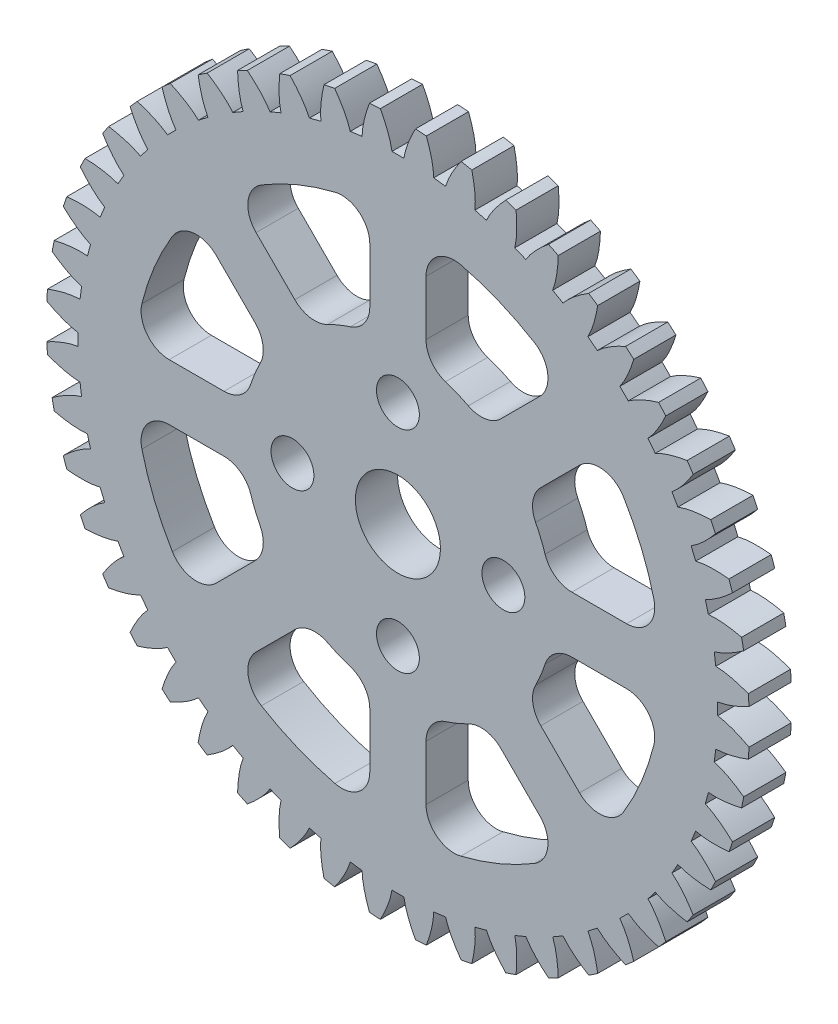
SolidWorks part; units mm, degrees
ref_plane "正面" through (0, 0, 0) normal (0, 0, 1) x (1, 0, 0)
ref_plane "平面" through (0, 0, 0) normal (0, 1, 0) x (1, 0, 0)
ref_plane "右側面" through (0, 0, 0) normal (1, 0, 0) x (0, 0, -1)
sketch "インボリュート スケッチ" plane through (0, 0, 0) normal (0, 0, 1) x (1, 0, 0)
  line L0 (-70.438, -23.8116) -> (0.4019, -22.549)
  line L1 (0.4019, -22.549) -> (-0.4019, 22.549) construction
  line L2 (0, 0) -> (0, 25) construction
  line L3 (-0.4019, 22.549) -> (-0.4054, 22.7464)
  line L4 (0, 0) -> (0.4019, -22.549)
  line L5 (-0.4054, 22.7464) -> (0, 22.7464)
  line L6 (0, 22.7464) -> (0, 0)
  circle A0 centre (0, 0) radius 22.5526 construction
  circle A1 centre (0, 0) radius 24 construction
  circle A2 centre (0, 0) radius 22.75 construction
  circle A3 centre (0, 0) radius 25 construction
  spline S0 degree 4 poles (-0.4019, 22.549) (-0.4043, 22.5919) (-0.4117, 22.6773) (-0.4369, 22.8471) (-0.4886, 23.0907) (-0.5628, 23.3644) (-0.6857, 23.7403) (-0.8782, 24.2318) (-1.1643, 24.8362) (-1.7417, 25.8497) (-2.6976, 27.1657) (-4.2523, 28.8251) (-6.5458, 30.6346) (-9.3246, 32.2398) (-12.5284, 33.5394) (-15.8665, 34.4327) (-19.283, 34.9432) (-22.9038, 35.1011) (-27.3837, 34.8283) (-32.6484, 33.82) (-38.5314, 31.7675) (-44.6351, 28.5052) (-49.5077, 24.9143) (-53.305, 21.3911) (-56.2012, 18.1959) (-58.352, 15.4987) (-60.3327, 12.6742) (-62.1401, 9.736) (-64.1797, 5.937) (-66.2726, 1.201) (-68.1932, -4.5312) (-69.3975, -10.0129) (-69.994, -14.2845) (-70.2598, -17.2892) (-70.355, -18.796) (-70.4098, -20.0849) (-70.4357, -21.0902) (-70.4466, -21.788) (-70.4498, -22.439) (-70.4494, -22.9528) (-70.4419, -23.6308) (-70.4328, -24.115) (-70.4123, -24.9069) (-70.3877, -25.5185) (-70.3541, -26.2633) (-70.3151, -26.928) (-70.2685, -27.6393) (-70.2157, -28.3236) (-70.1411, -29.1948) (-70.0385, -30.23) (-69.8993, -31.4416) (-69.7141, -32.8188) (-69.5557, -33.8513) (-69.4415, -34.5368) (-69.3823, -34.8798) knots 0 0 0 0 0 0.001401 0.002802 0.005604 0.008133 0.010661 0.015718 0.022839 0.02996 0.048734 0.068727 0.096889 0.125051 0.153212 0.181374 0.209535 0.237696 0.271429 0.327752 0.384075 0.440398 0.496721 0.524883 0.553044 0.581206 0.609367 0.637529 0.66569 0.722013 0.778336 0.834659 0.84874 0.86282 0.876901 0.883942 0.890982 0.895509 0.900036 0.904564 0.909091 0.914773 0.920455 0.926136 0.931818 0.9375 0.943182 0.948864 0.954545 0.965909 0.977273 0.988636 1 1 1 1 1 construction
  spline S1 degree 4 poles (-0.4019, 22.549) (-0.4043, 22.5919) (-0.4117, 22.6773) (-0.4369, 22.8471) (-0.4886, 23.0907) (-0.5628, 23.3644) (-0.6857, 23.7403) (-0.8782, 24.2318) (-1.1643, 24.8362) (-1.7417, 25.8497) (-2.6976, 27.1657) (-4.2523, 28.8251) (-6.5458, 30.6346) (-9.3246, 32.2398) (-12.5284, 33.5394) (-15.8665, 34.4327) (-19.283, 34.9432) (-22.9038, 35.1011) (-27.3837, 34.8283) (-32.6484, 33.82) (-38.5314, 31.7675) (-44.6351, 28.5052) (-49.5077, 24.9143) (-53.305, 21.3911) (-56.2012, 18.1959) (-58.352, 15.4987) (-60.3327, 12.6742) (-62.1401, 9.736) (-64.1797, 5.937) (-66.2726, 1.201) (-68.1932, -4.5312) (-69.3975, -10.0129) (-69.994, -14.2845) (-70.2598, -17.2892) (-70.355, -18.796) (-70.4098, -20.0849) (-70.4357, -21.0902) (-70.4466, -21.788) (-70.4498, -22.439) (-70.4494, -22.9528) (-70.4441, -23.4308) (-70.4403, -23.6856) (-70.438, -23.8116) knots 0 0 0 0 0 0.001401 0.002802 0.005604 0.008133 0.010661 0.015718 0.022839 0.02996 0.048734 0.068727 0.096889 0.125051 0.153212 0.181374 0.209535 0.237696 0.271429 0.327752 0.384075 0.440398 0.496721 0.524883 0.553044 0.581206 0.609367 0.637529 0.66569 0.722013 0.778336 0.834659 0.84874 0.86282 0.876901 0.883942 0.890982 0.895509 0.900036 0.904564 0.909091 0.909091 0.909091 0.909091 0.909091
  point P6 (-0.7853, 23.9872)
  point P12 (0, 24)
  point P24 (0, 0)
extrude "インボリュート ボス" add sketch "インボリュート スケッチ" along normal blind 3
mirror "インボリュート ミラー" about plane through (0, 0, 3) normal (1, 0, 0)
sketch "歯先円 スケッチ" plane through (0, 0, 3) normal (0, 0, 1) x (1, 0, 0)
  circle A0 centre (0, 0) radius 74.3539
  circle A1 centre (0, 0) radius 25
extrude "歯先円 カット" cut sketch "歯先円 スケッチ" against normal through all
sketch "歯分割 スケッチ" plane through (0, 0, 3) normal (0, 0, 1) x (1, 0, 0)
  line L0 (-1.6351, 24.9465) -> (0, 0)
  line L1 (0, 0) -> (1.6351, 24.9465)
  line L2 (0, 0) -> (0, 24) construction
  arc A0 (-1.6351, 24.9465) -> (1.6351, 24.9465) centre (0, 0) ccw
  circle A2 centre (0, 0) radius 24 construction
  arc A3 (-1.2492, 24.9688) -> (-10.3843, -22.7413) centre (0, 0) ccw construction
  point P9 (-1.5697, 23.9486)
  point P10 (1.5697, 23.9486)
extrude "歯分割 カット" cut sketch "歯分割 スケッチ" against normal through all
pattern_circular "歯分割 円形コピー" count 48 over 360 about axis through (0, 0, 0) along (0, 0, 1)
sketch "歯底円 スケッチ" plane through (0, 0, 3) normal (0, 0, 1) x (1, 0, 0)
  circle A0 centre (0, 0) radius 22.75
extrude "歯底円 ボス" add sketch "歯底円 スケッチ" against normal through all
sketch "軸 丸穴 スケッチ" plane through (0, 0, 3) normal (0, 0, 1) x (1, 0, 0)
  circle A0 centre (0, 0) radius 3.025
  dimension "D1" = 6.05
extrude "軸 丸穴 カット" cut sketch "軸 丸穴 スケッチ" against normal through all
sketch "軸 キー溝 スケッチ" plane through (0, 0, 3) normal (0, 0, 1) x (1, 0, 0)
  line L2 (-1.5, 3.7081) -> (-1.5, 5.4)
  line L3 (-1.5, 5.4) -> (1.5, 5.4)
  line L4 (1.5, 3.7081) -> (1.5, 5.4)
  arc A0 (-1.5, 3.7081) -> (1.5, 3.7081) centre (0, 0) ccw
  dimension "D1" = 8
  dimension "D2" = 3
  dimension "D3" = 5.4
extrude "軸 キー溝 カット" [suppressed] cut sketch "軸 キー溝 スケッチ" against normal through all
sketch "軸 Dカット スケッチ" plane through (0, 0, 3) normal (0, 0, 1) x (1, 0, 0)
  line L0 (-2.3958, 3) -> (2.3958, 3)
  arc A0 (-2.828, 2.8289) -> (2.828, 2.8289) centre (0, 0) ccw
  arc A1 (-2.3958, 3) -> (-2.828, 2.8289) centre (-2.6458, 3) ccw
  arc A2 (2.828, 2.8289) -> (2.3958, 3) centre (2.6458, 3) ccw
  dimension "D1" = 8
  dimension "D3" = 0.5
  dimension "D2" = 3
extrude "軸 Dカット カット" [suppressed] cut sketch "軸 Dカット スケッチ" against normal through all
sketch "軸 角穴 スケッチ" plane through (0, 0, 3) normal (0, 0, 1) x (1, 0, 0)
  line L0 (-5.1, 5.1) -> (5.1, 5.1)
  line L1 (-5, -5) -> (5, -5) construction
  line L2 (-5, -5) -> (-5, 5) construction
  line L3 (-5, 5) -> (5, 5) construction
  line L4 (5, -5) -> (5, 5) construction
  line L5 (-5, -5) -> (5, 5) construction
  line L6 (-5, 5) -> (5, -5) construction
  line L7 (5.1, -5.1) -> (5.1, 5.1)
  line L8 (-5.1, -5.1) -> (5.1, -5.1)
  line L9 (-5.1, -5.1) -> (-5.1, 5.1)
  point P0 (0, 0)
  dimension "D1" = 10
  dimension "D2" = 0.1
extrude "軸 角穴 カット" [suppressed] cut sketch "軸 角穴 スケッチ" against normal through all
sketch "フランジ穴 スケッチ" plane through (0, 0, 3) normal (0, 0, 1) x (1, 0, 0)
  circle A0 centre (0, 12) radius 1.6
  circle A1 centre (12, 0) radius 1.6
  circle A2 centre (0, -12) radius 1.6
  circle A3 centre (-12, 0) radius 1.6
  point P12 (0, 0)
  dimension "D2" = 3.2
  dimension "D3" = 12
  dimension "D1" = 4
extrude "フランジ穴 カット" [suppressed] cut sketch "フランジ穴 スケッチ" against normal through all
sketch "合致用スケッチ" plane through (0, 0, 3) normal (0, 0, 1) x (1, 0, 0)
  line L0 (0, 0) -> (0, 24)
  line L1 (0, 0) -> (1.5697, 23.9486)
  circle A2 centre (0, 0) radius 24
sketch "ｽｹｯﾁ1" plane through (0, 0, 0) normal (0, 0, -1) x (-1, 0, 0)
  line L0 (0, 0) -> (0, 24) construction
  circle A0 centre (0, 7.5) radius 1.525
  circle A1 centre (7.5, 0) radius 1.525
  circle A2 centre (0, -7.5) radius 1.525
  circle A3 centre (-7.5, 0) radius 1.525
  point P14 (0, 0)
  dimension "D1" = 7.5
  dimension "D2" = 3.05
  dimension "D3" = 4
extrude "ｶｯﾄ - 押し出し1" cut sketch "ｽｹｯﾁ1" against normal through all
chamfer "面取り1" [suppressed] distance 1.75 angle 45
sketch "ｽｹｯﾁ2" plane through (0, 0, 3) normal (0, 0, 1) x (1, 0, 0)
  line L0 (0, 0) -> (0, -22.7464) construction
  line L1 (-0.4054, -22.7464) -> (0.4054, -22.7464) construction
  line L2 (0, 0) -> (-16.0841, -16.0841) construction
  line L3 (0, 0) -> (-22.7464, 0) construction
  line L4 (0, 0) -> (-16.0841, 16.0841) construction
  line L5 (0, 0) -> (0, 22.7464) construction
  line L6 (0, 0) -> (16.0841, 16.0841) construction
  line L7 (0, 0) -> (22.7464, 0) construction
  line L8 (0, 0) -> (16.0841, -16.0841) construction
  line L9 (-6.2343, -9.0627) -> (-11.7684, -14.5968)
  line L10 (-2, -18.643) -> (-2, -10.8167)
  line L11 (-14.5968, -11.7684) -> (-9.0627, -6.2343)
  line L12 (-10.8167, -2) -> (-18.643, -2)
  line L13 (-18.643, 2) -> (-10.8167, 2)
  line L14 (-9.0627, 6.2343) -> (-14.5968, 11.7684)
  line L15 (-11.7684, 14.5968) -> (-6.2343, 9.0627)
  line L16 (-2, 10.8167) -> (-2, 18.643)
  line L17 (2, 18.643) -> (2, 10.8167)
  line L18 (6.2343, 9.0627) -> (11.7684, 14.5968)
  line L19 (14.5968, 11.7684) -> (9.0627, 6.2343)
  line L20 (10.8167, 2) -> (18.643, 2)
  line L21 (18.643, -2) -> (10.8167, -2)
  line L22 (9.0627, -6.2343) -> (14.5968, -11.7684)
  line L23 (11.7684, -14.5968) -> (6.2343, -9.0627)
  line L24 (2, -10.8167) -> (2, -18.643)
  arc A0 (-2, -10.8167) -> (-6.2343, -9.0627) centre (0, 0) cw
  arc A1 (-2, -18.643) -> (-11.7684, -14.5968) centre (0, 0) cw
  arc A2 (-9.0627, -6.2343) -> (-10.8167, -2) centre (0, 0) cw
  arc A3 (-14.5968, -11.7684) -> (-18.643, -2) centre (0, 0) cw
  arc A4 (-10.8167, 2) -> (-9.0627, 6.2343) centre (0, 0) cw
  arc A5 (-18.643, 2) -> (-14.5968, 11.7684) centre (0, 0) cw
  arc A6 (-6.2343, 9.0627) -> (-2, 10.8167) centre (0, 0) cw
  arc A7 (-11.7684, 14.5968) -> (-2, 18.643) centre (0, 0) cw
  arc A8 (2, 10.8167) -> (6.2343, 9.0627) centre (0, 0) cw
  arc A9 (2, 18.643) -> (11.7684, 14.5968) centre (0, 0) cw
  arc A10 (9.0627, 6.2343) -> (10.8167, 2) centre (0, 0) cw
  arc A11 (14.5968, 11.7684) -> (18.643, 2) centre (0, 0) cw
  arc A12 (10.8167, -2) -> (9.0627, -6.2343) centre (0, 0) cw
  arc A13 (18.643, -2) -> (14.5968, -11.7684) centre (0, 0) cw
  arc A14 (6.2343, -9.0627) -> (2, -10.8167) centre (0, 0) cw
  arc A15 (11.7684, -14.5968) -> (2, -18.643) centre (0, 0) cw
  point P14 (0, 0)
  point P47 (0, 0)
  dimension "D2" = 11
  dimension "D3" = 18.75
  dimension "D4" = 2
  dimension "D5" = 2
  dimension "D1" = 8
  dimension "D6" = 8
extrude "ｶｯﾄ - 押し出し2" cut sketch "ｽｹｯﾁ2" against normal through all
fillet "ﾌｨﾚｯﾄ1" radius 2 32 edges at (-2, -18.643, 1.5) (-11.7684, -14.5968, 1.5) (-6.2343, -9.0627, 1.5) (-2, -10.8167, 1.5) (14.5968, 11.7684, 1.5) (18.643, 2, 1.5) (10.8167, 2, 1.5) (9.0627, 6.2343, 1.5) (18.643, -2, 1.5) (14.5968, -11.7684, 1.5) (9.0627, -6.2343, 1.5) (10.8167, -2, 1.5) (11.7684, -14.5968, 1.5) (2, -18.643, 1.5) (2, -10.8167, 1.5) (6.2343, -9.0627, 1.5) (-14.5968, -11.7684, 1.5) (-18.643, -2, 1.5) (-10.8167, -2, 1.5) (-9.0627, -6.2343, 1.5) (-18.643, 2, 1.5) (-14.5968, 11.7684, 1.5) (-9.0627, 6.2343, 1.5) (-10.8167, 2, 1.5) (-11.7684, 14.5968, 1.5) (-2, 10.8167, 1.5) (-6.2343, 9.0627, 1.5) (2, 18.643, 1.5) (11.7684, 14.5968, 1.5) (6.2343, 9.0627, 1.5) (2, 10.8167, 1.5) (-2, 18.643, 1.5)
equation "\"モジュール\"= 1."
equation "\"基準圧力角\"= 20"
equation "\"歯数\"= 48"
equation "\"基準円直径\"= \"歯数\" * \"モジュール\""
equation "\"基礎円直径\"= \"基準円直径\" * cos ( \"基準圧力角\" )"
equation "\"歯先円直径\"= \"基準円直径\" + 2 * \"モジュール\""
equation "\"歯底円直径\"= \"基準円直径\" - 2.5 * \"モジュール\""
equation "\"D1@インボリュート スケッチ\" = \"基礎円直径\""
equation "\"D2@インボリュート スケッチ\" = \"基準円直径\""
equation "\"D3@インボリュート スケッチ\" = \"歯底円直径\""
equation "\"D4@インボリュート スケッチ\" = \"歯先円直径\""
equation "\"D5@インボリュート スケッチ\" = Pi * \"モジュール\" / 4"
equation "\"D1@歯先円 スケッチ\" = \"歯先円直径\""
equation "\"D1@歯分割 スケッチ\" = \"基準円直径\""
equation "\"D2@歯分割 スケッチ\" = PI * \"モジュール\""
equation "\"D1@歯分割 円形コピー\" = \"歯数\""
equation "\"D1@歯底円 スケッチ\" = \"歯底円直径\""
equation "\"板厚\"= 3"
equation "\"D1@インボリュート ボス\"=\"板厚\""
equation "\"D1@合致用スケッチ\" = \"基準円直径\""
equation "\"D2@合致用スケッチ\"=180/\"歯数\""
